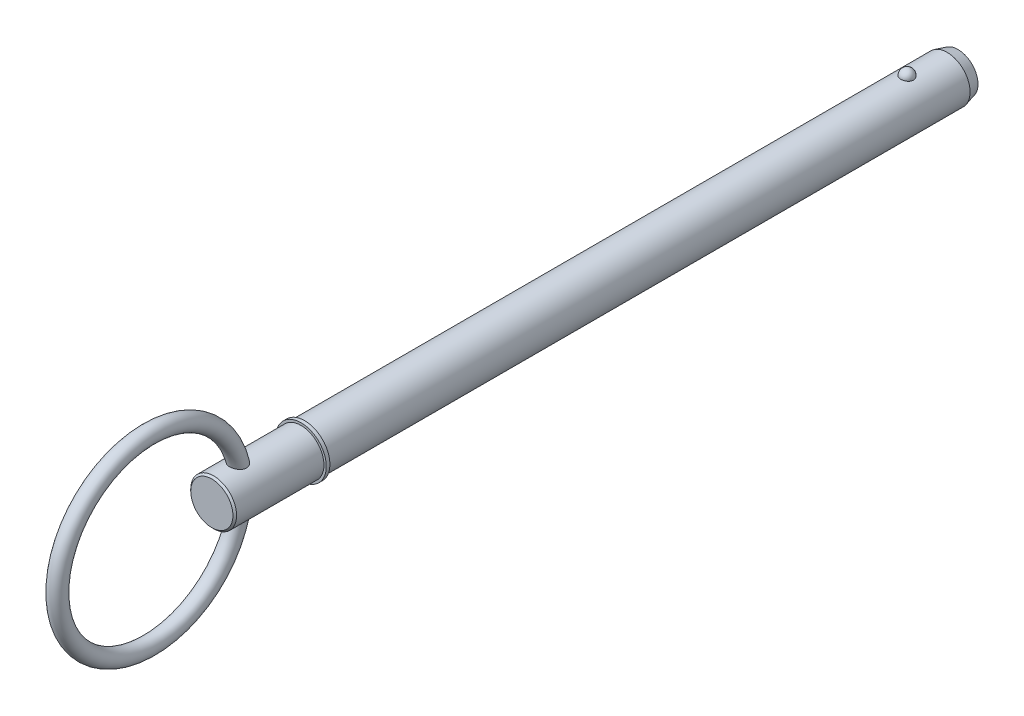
SolidWorks part; units mm, degrees
ref_plane "Front Plane" through (0, 0, 0) normal (0, 0, 1) x (1, 0, 0)
ref_plane "Top Plane" through (0, 0, 0) normal (0, 1, 0) x (1, 0, 0)
ref_plane "Right Plane" through (0, 0, 0) normal (1, 0, 0) x (0, 0, -1)
sketch "Sketch2" plane through (0, 0, 0) normal (0, 0, 1) x (1, 0, 0)
  circle A0 centre (0, 0) radius 6.35
  point P3 (0, 6.35)
  dimension "D1" = 12.7
extrude "Boss-Extrude1" add sketch "Sketch2" along normal blind 165.1
sketch "Sketch3" plane through (0, 0, 0) normal (0, 0, -1) x (-1, 0, 0)
  circle A0 centre (0, 0) radius 6.35
  dimension "D1" = 12.7
extrude "Boss-Extrude2" add sketch "Sketch3" along normal blind 15.88
chamfer "Chamfer1" distance 3 angle 15 1 edges at (-6.35, 0, -15.88)
sketch "Sketch18" plane through (0, 0, 0) normal (1, 0, 0) x (0, 0, -1)
  line L0 (12.88, 6.35) -> (-165.1, 6.35) construction
  line L1 (1.78, 8.13) -> (1.78, 4.57)
  line L2 (-165.1, -6.35) -> (12.88, -6.35) construction
  arc A0 (1.78, 8.13) -> (1.78, 4.57) centre (1.78, 6.35) ccw
  point P4 (0, 6.35)
  dimension "D1" = 14.48
revolve "Revolve1" add sketch "Sketch18" angle 360 about L1
sketch "Sketch19" plane through (0, 0, 0) normal (1, 0, 0) x (0, 0, -1)
  line L0 (-33.7288, 0) -> (-46.4542, 0) construction
sketch "Sketch20" plane through (0, 0, 0) normal (1, 0, 0) x (0, 0, -1)
  line L0 (-165.1, 0) -> (-165.1, 7)
  line L1 (-165.1, 6.35) -> (-165.1, -6.35) construction
  line L2 (-165.1, 7) -> (-166.1, 7)
  line L3 (-166.1, 7) -> (-166.1, 0)
  line L4 (-33.7288, 0) -> (-46.4542, 0) construction
  line L5 (-166.1, 0) -> (-165.1, 0)
  dimension "D1" = 7
  dimension "D2" = 1
revolve "Revolve2" add sketch "Sketch20" angle 360 about L0
sketch "Sketch21" plane through (0, 0, 165.1) normal (0, 0, -1) x (-1, 0, 0)
  circle A0 centre (0, 0) radius 6.35
  dimension "D1" = 12.7
extrude "Boss-Extrude3" add sketch "Sketch21" against normal blind 25.7
chamfer "Chamfer2" distance 0.5 angle 45 1 edges at (-6.35, 0, 190.8)
sketch "Sketch23" plane through (0, 0, 0) normal (1, 0, 0) x (0, 0, -1)
  line L0 (-190.8, 5.85) -> (-190.8, -5.85) construction
  circle A0 centre (-208.2, 0) radius 25.4
  point P2 (-182.8, 0)
  dimension "D1" = 50.8
  dimension "D2" = 8
sketch "Sketch24" plane through (0, 0, 0) normal (0, 1, 0) x (1, 0, 0)
  circle A0 centre (0, -182.8) radius 2.25
  dimension "D1" = 4.5
sweep "Sweep1" add profiles "Sketch24" path "Sketch23"
